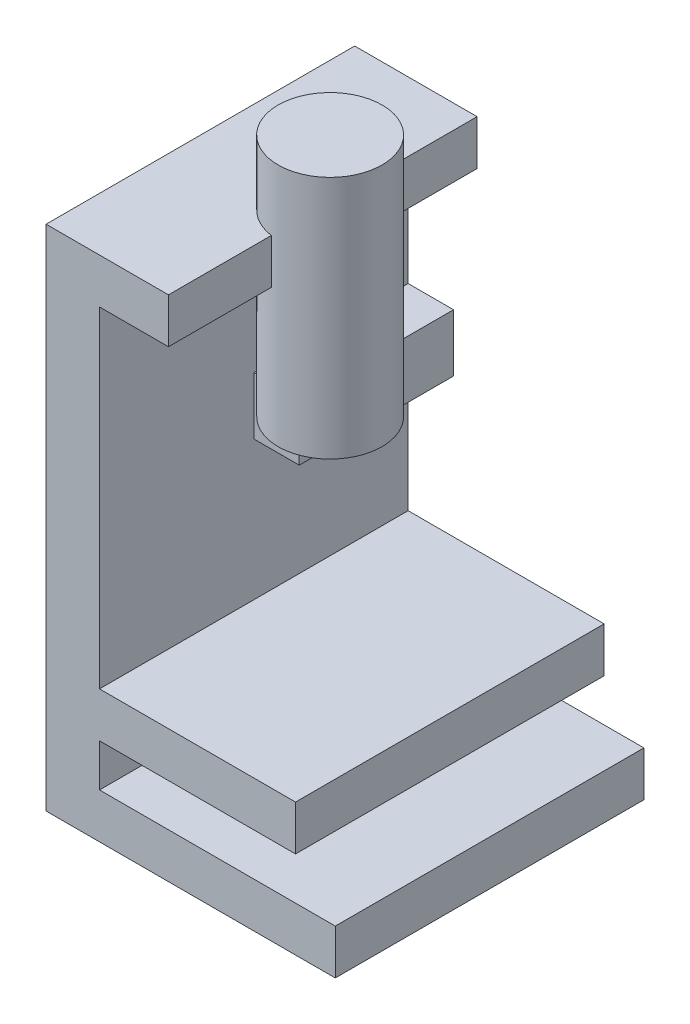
SolidWorks part; units mm, degrees
ref_plane "Front" through (0, 0, 0) normal (0, 0, 1) x (1, 0, 0)
ref_plane "Top" through (0, 0, 0) normal (0, 1, 0) x (1, 0, 0)
ref_plane "Right" through (0, 0, 0) normal (1, 0, 0) x (0, 0, -1)
sketch "Sketch1" plane through (8.5643, -28.3878, 0) normal (0, 0, 1) x (0, 1, 0)
  line L0 (-58.1634, -54.4213) -> (98.2773, -54.4213)
  line L1 (-31.2198, -131.2019) -> (-17.3789, -131.2019)
  line L2 (-17.3789, -131.2019) -> (-17.3789, -70.8632)
  line L4 (98.2773, -54.4213) -> (98.2773, -92.0903)
  line L6 (-58.1634, -143.4403) -> (-58.1634, -54.4213)
  line L16 (-131.7247, -54.4213) -> (174.6253, -54.4213) construction
  line L17 (-17.3789, -70.8632) -> (25.4963, -70.8632)
  line L18 (43.1793, -70.8632) -> (84.4364, -70.8632)
  line L19 (43.1793, -84.8357) -> (43.1793, -70.8632)
  line L20 (25.4963, -84.8357) -> (43.1793, -84.8357)
  line L21 (25.4963, -70.8632) -> (25.4963, -84.8357)
  line L24 (-31.2198, -70.8632) -> (-31.2198, -131.2019)
  line L25 (-58.1634, -143.4403) -> (-44.3225, -143.4403)
  line L26 (84.4364, -92.0903) -> (98.2773, -92.0903)
  line L27 (84.4364, -70.8632) -> (84.4364, -92.0903)
  line L28 (-44.3225, -70.8632) -> (-31.2198, -70.8632)
  line L29 (-44.3225, -143.4403) -> (-44.3225, -70.8632)
extrude "Extrude1" add sketch "Sketch1" along normal mid plane 95
ref_plane "Plane1" through (0, 79.8894, 0) normal (0, 1, 0) x (-1, 0, 0)
sketch "Sketch3" plane through (0, 14.7915, 0) normal (0, 1, 0) x (-1, 0, 0)
  line L0 (-79.4274, 0) -> (-93.3999, 0)
  line L4 (-93.3999, -47.5) -> (-79.4274, -47.5)
  line L5 (-79.4274, -47.5) -> (-79.4274, 47.5)
  line L6 (-79.4274, 47.5) -> (-93.3999, 47.5)
  line L7 (-93.3999, 47.5) -> (-93.3999, -47.5)
  line L9 (-79.4274, 0) -> (-79.4274, 47.5)
  line L10 (-79.4274, 47.5) -> (-93.3999, 47.5)
  line L11 (-93.3999, 47.5) -> (-93.3999, 0)
  dimension "D1" = 0
extrude "Cut-Extrude1" cut sketch "Sketch3" against normal up to next
sketch "Sketch2" plane through (0, 79.8894, 0) normal (0, 1, 0) x (-1, 0, 0)
  circle A0 centre (-102.9143, 0) radius 15.9977
extrude "Boss-Extrude1" add sketch "Sketch2" against normal up to vertex (65.098 mm away) from offset 10 separate body
